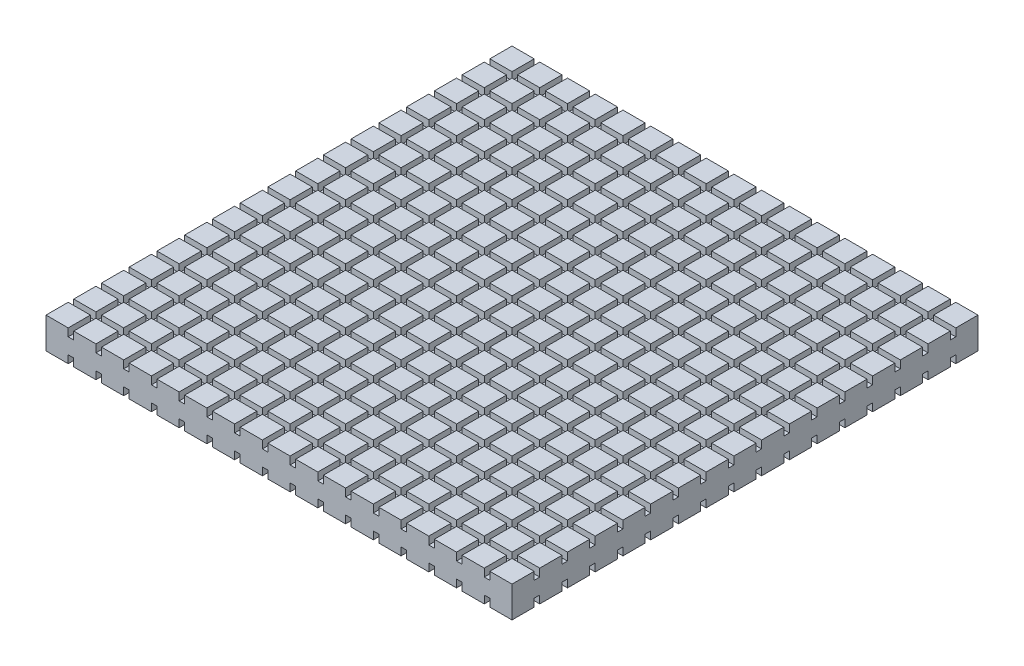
SolidWorks part; units mm, degrees
ref_plane "Front Plane" through (0, 0, 0) normal (0, 0, 1) x (1, 0, 0)
ref_plane "Top Plane" through (0, 0, 0) normal (0, 1, 0) x (1, 0, 0)
ref_plane "Right Plane" through (0, 0, 0) normal (1, 0, 0) x (0, 0, -1)
sketch "Sketch1" plane through (0, 0, 0) normal (0, 1, 0) x (1, 0, 0)
  line L1 (105, -105) -> (-105, -105)
  line L2 (105, -105) -> (105, 105)
  line L3 (105, 105) -> (-105, 105)
  line L4 (-105, -105) -> (-105, 105)
  line L5 (105, -105) -> (-105, 105) construction
  line L6 (105, 105) -> (-105, -105) construction
  point P0 (0, 0)
  dimension "D1" = 210
extrude "Boss-Extrude1" add sketch "Sketch1" along normal mid plane 7
sketch "Sketch2" plane through (0, 0, 0) normal (0, 1, 0) x (1, 0, 0)
  line L0 (-105, 105) -> (-105, -105) construction
  line L1 (-105, -105) -> (-95, -105)
  line L2 (-105, -105) -> (-105, -95)
  line L3 (-105, -95) -> (-95, -95)
  line L4 (-95, -105) -> (-95, -95)
  line L5 (-105, -105) -> (-95, -95) construction
  line L6 (-105, -95) -> (-95, -105) construction
  line L7 (-105, -105) -> (105, -105) construction
  point P0 (-100, -100)
  dimension "D1" = 10
extrude "Boss-Extrude2" add sketch "Sketch2" along normal mid plane 14
pattern_linear "LPattern4" count 17 spacing 12.5 along (0, 0, -1) of "Boss-Extrude2"
pattern_linear "LPattern5" count 17 spacing 12.5 along (1, 0, 0) of "LPattern4", "Boss-Extrude2"
